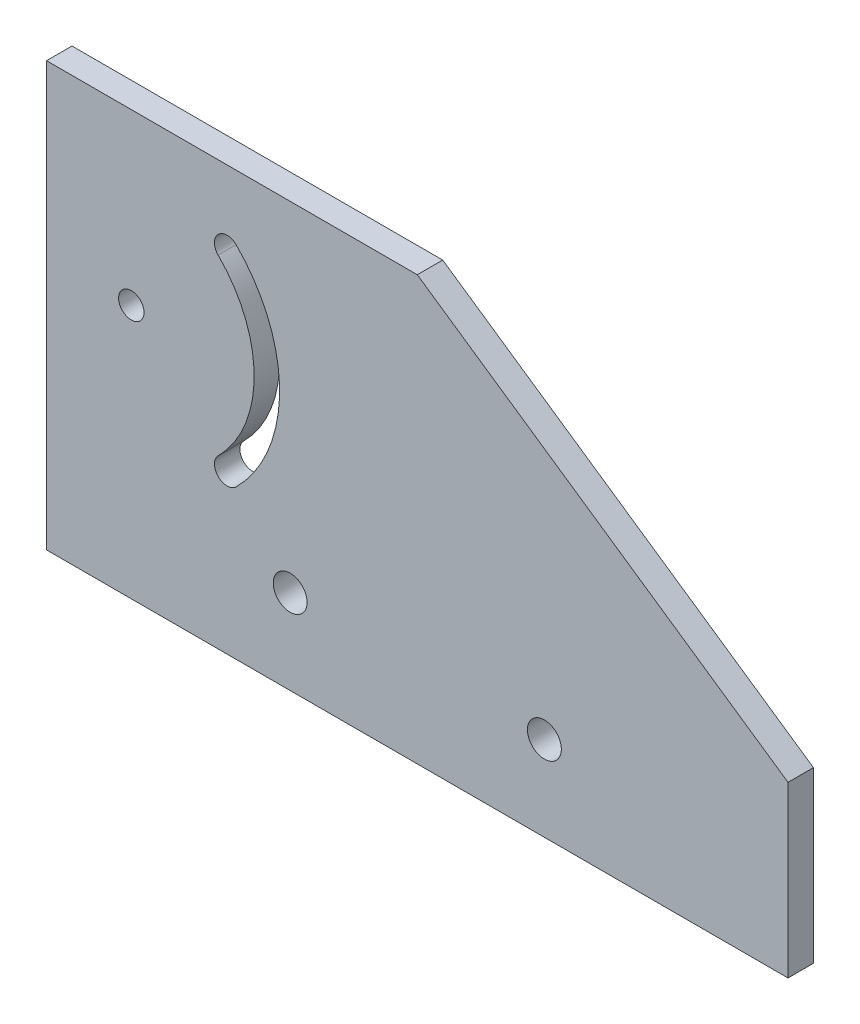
SolidWorks part; units mm, degrees
ref_plane "前视基准面" through (0, 0, 0) normal (0, 0, 1) x (1, 0, 0)
ref_plane "上视基准面" through (0, 0, 0) normal (0, 1, 0) x (1, 0, 0)
ref_plane "右视基准面" through (0, 0, 0) normal (1, 0, 0) x (0, 0, -1)
sketch "草图1" plane through (0, 0, 0) normal (0, 0, 1) x (1, 0, 0)
  line L1 (-43.75, 25) -> (43.75, 25)
  line L2 (-43.75, 25) -> (-43.75, -25)
  line L3 (-43.75, -25) -> (43.75, -25)
  line L4 (43.75, 25) -> (43.75, -25)
  line L5 (-43.75, 25) -> (43.75, -25) construction
  line L6 (-43.75, -25) -> (43.75, 25) construction
  point P0 (0, 0)
  dimension "D1" = 50
  dimension "D2" = 87.5
extrude "凸台-拉伸1" add sketch "草图1" along normal blind 3
hole_wizard "Ø4.0 (4) 直径孔1" positions "草图2" profile "草图3" hole size "Ø4.0" standard "GB"
sketch "草图2" plane through (0, 0, 3) normal (0, 0, 1) x (1, 0, 0)
  line L0 (-43.75, -25) -> (43.75, -25) construction
  point P0 (-15, -15)
  point P2 (15, -15)
  dimension "D1" = 30
  dimension "D2" = 15
  dimension "D3" = 10
  dimension "D4" = 10
sketch "草图3" plane through (-15, -15, 3) normal (1, 0, 0) x (0, -1, 0)
  line L0 (0, 0) -> (0, 3)
  line L1 (0, 3) -> (2, 3)
  line L2 (2, 3) -> (2, 0)
  line L5 (2, 0) -> (0, 0)
  line L11 (0, -6.35) -> (0, 107.95) construction
  dimension "通孔孔直径" = 4
  dimension "通孔孔深度" = 3
sketch "草图5" plane through (0, 0, 3) normal (0, 0, 1) x (1, 0, 0)
  line L0 (0, 25) -> (43.75, 25)
  line L1 (43.75, 25) -> (-43.75, 25) construction
  line L2 (43.75, 25) -> (43.75, -5)
  line L3 (43.75, -5) -> (0, 25)
extrude "切除-拉伸2" cut sketch "草图5" against normal blind 10
sketch "草图6" plane through (0, 0, 3) normal (0, 0, 1) x (1, 0, 0)
  line L2 (0, 25) -> (-43.75, 25) construction
  line L3 (-43.75, 25) -> (-43.75, -25) construction
  circle A0 centre (-33.75, 5) radius 1.5
  arc A1 (-22.4363, 16.3137) -> (-22.4363, -6.3137) centre (-33.75, 5) cw construction
  arc A2 (-21.3756, -7.3744) -> (-21.3756, 17.3744) centre (-33.75, 5) ccw
  arc A3 (-23.497, -5.253) -> (-23.497, 15.253) centre (-33.75, 5) ccw
  arc A4 (-23.497, -5.253) -> (-21.3756, -7.3744) centre (-22.4363, -6.3137) ccw
  arc A5 (-21.3756, 17.3744) -> (-23.497, 15.253) centre (-22.4363, 16.3137) ccw
  point P4 (-17.75, 5)
  point P9 (-13.6907, 5.0321)
  point P14 (0, 0)
  point P15 (0, 0)
  point P16 (0, 0)
  point P17 (-8.7682, 4.0468)
  dimension "D1" = 3
  dimension "D2" = 1.5
  dimension "D6" = 16
  dimension "D3" = 90
  dimension "D4" = 20
  dimension "D5" = 10
  dimension "D7" = 20
extrude "切除-拉伸3" cut sketch "草图6" against normal blind 24
